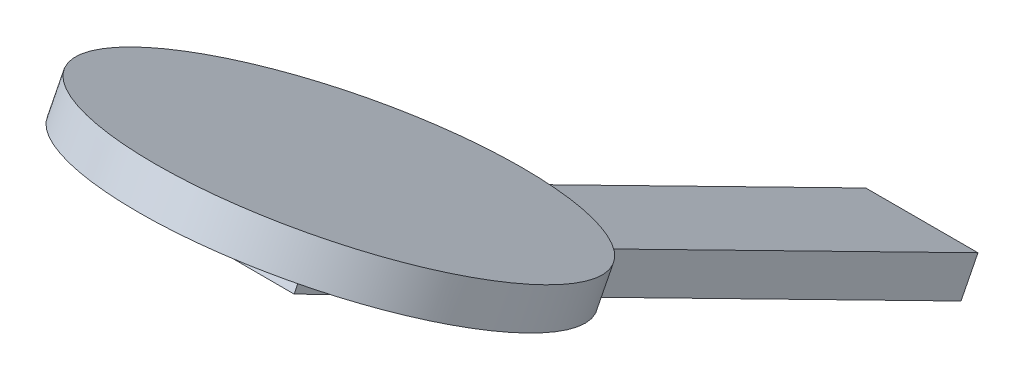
SolidWorks part; units mm, degrees
ref_plane "Ebene vorne" through (0, 0, 0) normal (0, 0, 1) x (1, 0, 0)
ref_plane "Ebene oben" through (0, 0, 0) normal (0, 1, 0) x (1, 0, 0)
ref_plane "Ebene rechts" through (0, 0, 0) normal (1, 0, 0) x (0, 0, -1)
sketch "Skizze2" plane through (0, 259.1774, -131.918) normal (0, -0.8912, 0.4536) x (-1, 0, 0)
  circle A0 centre (0, 0) radius 55.0875
  circle A1 centre (0, 0) radius 42.6475 construction
  point P4 (27.5022, -32.5951)
  point P5 (-28.8716, -31.3886)
  point P6 (-30.6655, 29.6384)
  point P7 (30.6655, 29.6384)
extrude "Linear austragen1" add sketch "Skizze2" along normal blind 10
sketch "Skizze3" plane through (0, 250.2654, -127.3819) normal (0, -0.8912, 0.4536) x (-1, 0, 0)
  line L0 (0, -20.0001) -> (0, 180.0568) construction
  line L1 (-15, -20.0571) -> (15, -19.9432)
  line L2 (-15, -20.0571) -> (-15, 180.0568)
  line L3 (-15, 180.0568) -> (15, 180.0568)
  line L4 (15, -19.9432) -> (15, 180.0568)
  dimension "D1" = 30
  dimension "D2" = 200
  dimension "D3" = 20
extrude "Linear austragen2" add sketch "Skizze3" along normal blind 10
